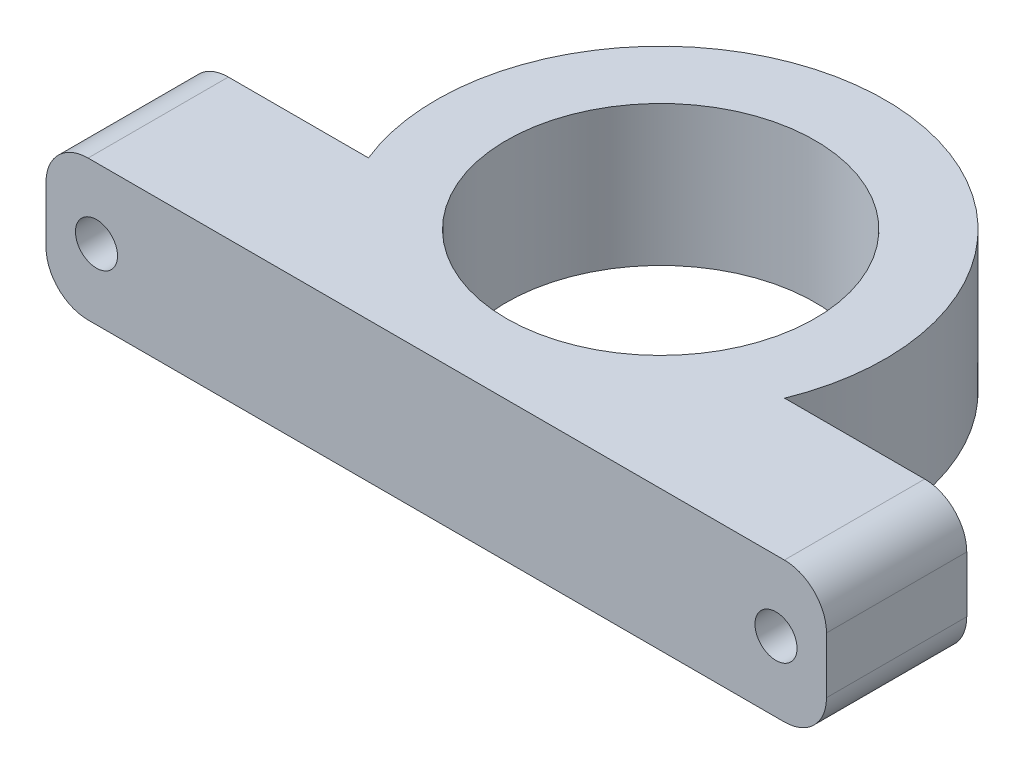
SolidWorks part; units mm, degrees
ref_plane "Front Plane" through (0, 0, 0) normal (0, 0, 1) x (1, 0, 0)
ref_plane "Top Plane" through (0, 0, 0) normal (0, 1, 0) x (1, 0, 0)
ref_plane "Right Plane" through (0, 0, 0) normal (1, 0, 0) x (0, 0, -1)
sketch "Sketch1" plane through (0, 0, 0) normal (0, 1, 0) x (1, 0, 0)
  line L0 (-27.8185, -16) -> (27.8185, -16)
  line L1 (-27.8185, -16) -> (-27.8185, -6)
  line L2 (-27.8185, -6) -> (-14.8324, -6)
  line L3 (27.8185, -16) -> (27.8185, -6)
  line L4 (27.8185, -6) -> (14.8324, -6)
  circle A0 centre (0, 0) radius 11
  circle A1 centre (0, 0) radius 16
  dimension "D1" = 22
  dimension "D2" = 32
  dimension "D3" = 10
  dimension "D5" = 55.6371
extrude "Boss-Extrude1" add sketch "Sketch1" along normal blind 10 contours A1 A0 | A1 L2 L1 L0 | A1 L0 L3 L4
sketch "Sketch2" plane through (0, 0, 6) normal (0, 0, -1) x (-1, 0, 0)
  line L0 (-24.2185, 5) -> (-27.8185, 5) construction
  line L1 (-27.8185, 10) -> (-27.8185, 0) construction
  line L2 (24.2185, 5) -> (27.8185, 5) construction
  line L3 (27.8185, 10) -> (27.8185, 0) construction
  circle A0 centre (-24.2185, 5) radius 1.5
  circle A1 centre (24.2185, 5) radius 1.5
  dimension "D1" = 3
  dimension "D2" = 3
  dimension "D3" = 3.6
extrude "Cut-Extrude1" cut sketch "Sketch2" against normal through all
fillet "Fillet1" radius 3 4 edges at (27.8185, 0, 11) (27.8185, 10, 11) (-27.8185, 0, 11) (-27.8185, 10, 11)
